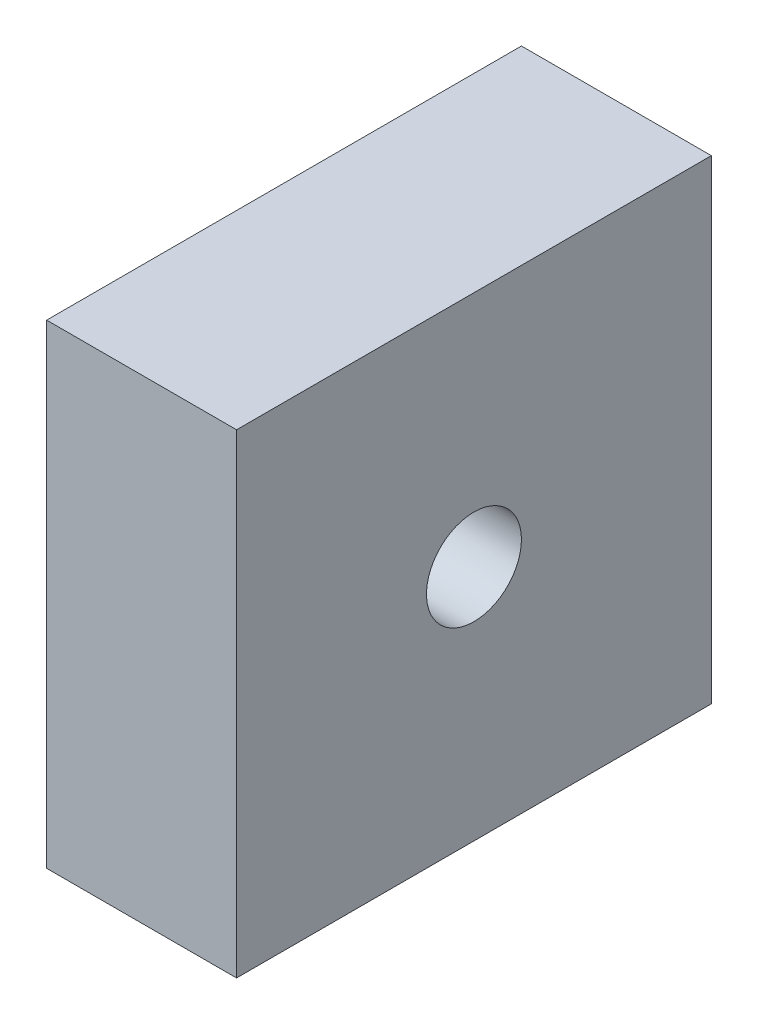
SolidWorks part; units mm, degrees
ref_plane "Front Plane" through (0, 0, 0) normal (0, 0, 1) x (1, 0, 0)
ref_plane "Top Plane" through (0, 0, 0) normal (0, 1, 0) x (1, 0, 0)
ref_plane "Right Plane" through (0, 0, 0) normal (1, 0, 0) x (0, 0, -1)
sketch "Sketch1" plane through (0, 0, 0) normal (1, 0, 0) x (0, 0, -1)
  line L1 (0, 0) -> (50, 0)
  line L2 (0, 0) -> (0, 50)
  line L3 (0, 50) -> (50, 50)
  line L4 (50, 0) -> (50, 50)
  circle A0 centre (25, 25) radius 5
extrude "Boss-Extrude1" add sketch "Sketch1" along normal blind 20
